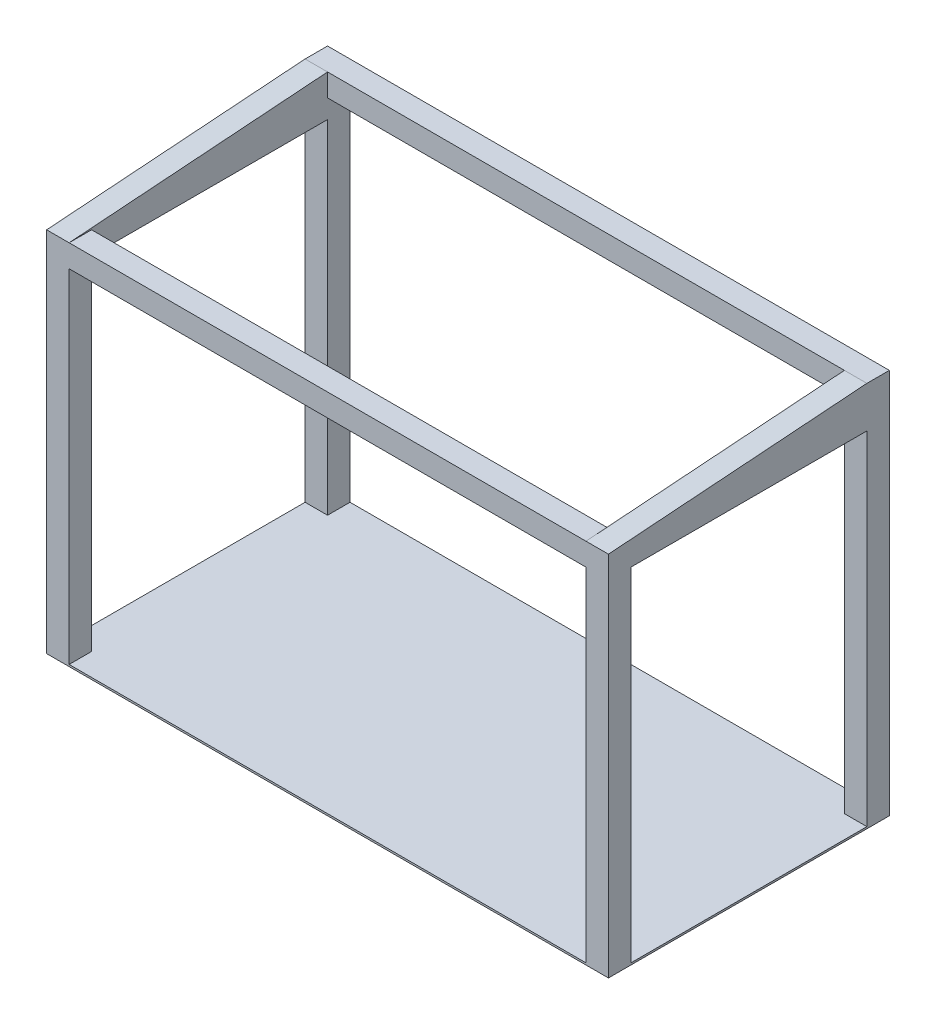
SolidWorks part; units mm, degrees
ref_plane "Front" through (0, 0, 0) normal (0, 0, 1) x (1, 0, 0)
ref_plane "Top" through (0, 0, 0) normal (0, 1, 0) x (1, 0, 0)
ref_plane "Right" through (0, 0, 0) normal (1, 0, 0) x (0, 0, -1)
sketch "Esquisse1" plane through (0, 0, 0) normal (0, 1, 0) x (1, 0, 0)
  line L1 (-1500, -750) -> (1500, -750)
  line L2 (-1500, -750) -> (-1500, 750)
  line L3 (-1500, 750) -> (1500, 750)
  line L4 (1500, -750) -> (1500, 750)
  line L5 (-1500, -750) -> (1500, 750) construction
  line L6 (-1500, 750) -> (1500, -750) construction
  point P0 (0, 0)
  dimension "D1" = 3000
  dimension "D2" = 1500
extrude "Boss.-Extru.1" add sketch "Esquisse1" along normal blind 10
sketch "Esquisse2" plane through (0, 10, 0) normal (0, 1, 0) x (1, 0, 0)
  line L0 (0, 0) -> (0, 307.353) construction
  line L1 (-1500, 750) -> (-1380, 750)
  line L2 (-1500, 750) -> (-1500, 630)
  line L3 (-1500, 630) -> (-1380, 630)
  line L4 (-1380, 750) -> (-1380, 630)
  line L5 (0, 0) -> (352.5978, 0) construction
  line L6 (1380, 750) -> (1380, 630)
  line L7 (1500, 630) -> (1380, 630)
  line L8 (1500, 750) -> (1500, 630)
  line L9 (1500, 750) -> (1380, 750)
  line L10 (1500, -750) -> (1380, -750)
  line L11 (1500, -750) -> (1500, -630)
  line L12 (1500, -630) -> (1380, -630)
  line L13 (1380, -750) -> (1380, -630)
  line L14 (-1380, -750) -> (-1380, -630)
  line L15 (-1500, -630) -> (-1380, -630)
  line L16 (-1500, -750) -> (-1500, -630)
  line L17 (-1500, -750) -> (-1380, -750)
  dimension "D1" = 120
  dimension "D2" = 120
extrude "Boss.-Extru.2" add sketch "Esquisse2" along normal blind 1950
sketch "Esquisse3" plane through (0, 0, -630) normal (0, 0, 1) x (1, 0, 0)
  line L0 (-1380, 1960) -> (-1380, 10) construction
  line L1 (-1500, 1960) -> (-1380, 1960)
  line L2 (-1500, 1960) -> (-1500, 1840)
  line L3 (-1500, 1840) -> (-1380, 1840)
  line L4 (-1380, 1960) -> (-1380, 1840)
  line L5 (1500, 1960) -> (1500, 10) construction
  line L6 (1380, 1960) -> (1500, 1960)
  line L7 (1380, 1960) -> (1380, 1840)
  line L8 (1380, 1840) -> (1500, 1840)
  line L9 (1500, 1960) -> (1500, 1840)
  dimension "D1" = 120
extrude "Boss.-Extru.3" add sketch "Esquisse3" along normal blind 1260
sketch "Esquisse4" plane through (-1380, 0, 0) normal (1, 0, 0) x (0, 0, -1)
  line L1 (-630, 1840) -> (-750, 1840)
  line L2 (-630, 1840) -> (-630, 1960)
  line L3 (-630, 1960) -> (-750, 1960)
  line L4 (-750, 1840) -> (-750, 1960)
  dimension "D1" = 120
extrude "Boss.-Extru.5" add sketch "Esquisse4" along normal blind 2760
sketch "Esquisse6" plane through (0, 1960, 0) normal (0, 1, 0) x (1, 0, 0)
  line L1 (1500, 630) -> (1380, 630)
  line L2 (1500, 630) -> (1500, 750)
  line L3 (1500, 750) -> (1380, 750)
  line L4 (1380, 630) -> (1380, 750)
  line L5 (-1500, 630) -> (-1380, 630)
  line L6 (-1500, 630) -> (-1500, 750)
  line L7 (-1500, 750) -> (-1380, 750)
  line L8 (-1380, 630) -> (-1380, 750)
extrude "Boss.-Extru.6" add sketch "Esquisse6" along normal blind 100
sketch "Esquisse7" plane through (-1500, 0, 0) normal (-1, 0, 0) x (0, 0, 1)
  line L0 (-630, 2060) -> (-630, 1960)
  line L1 (-630, 1960) -> (750, 1960)
  line L2 (750, 1960) -> (-630, 2060)
extrude "Boss.-Extru.7" add sketch "Esquisse7" against normal blind 120
sketch "Esquisse8" plane through (1500, 0, 0) normal (1, 0, 0) x (0, 0, -1)
  line L0 (630, 2060) -> (630, 1960)
  line L1 (630, 1960) -> (-750, 1960)
  line L2 (-750, 1960) -> (630, 2060)
extrude "Boss.-Extru.8" add sketch "Esquisse8" against normal blind 120
sketch "Esquisse9" plane through (1380, 0, 0) normal (-1, 0, 0) x (0, 0, 1)
  line L1 (-750, 2060) -> (-630, 2060)
  line L2 (-750, 2060) -> (-750, 1940)
  line L3 (-750, 1940) -> (-630, 1940)
  line L4 (-630, 2060) -> (-630, 1940)
  dimension "D1" = 120
extrude "Boss.-Extru.9" add sketch "Esquisse9" along normal blind 2760
